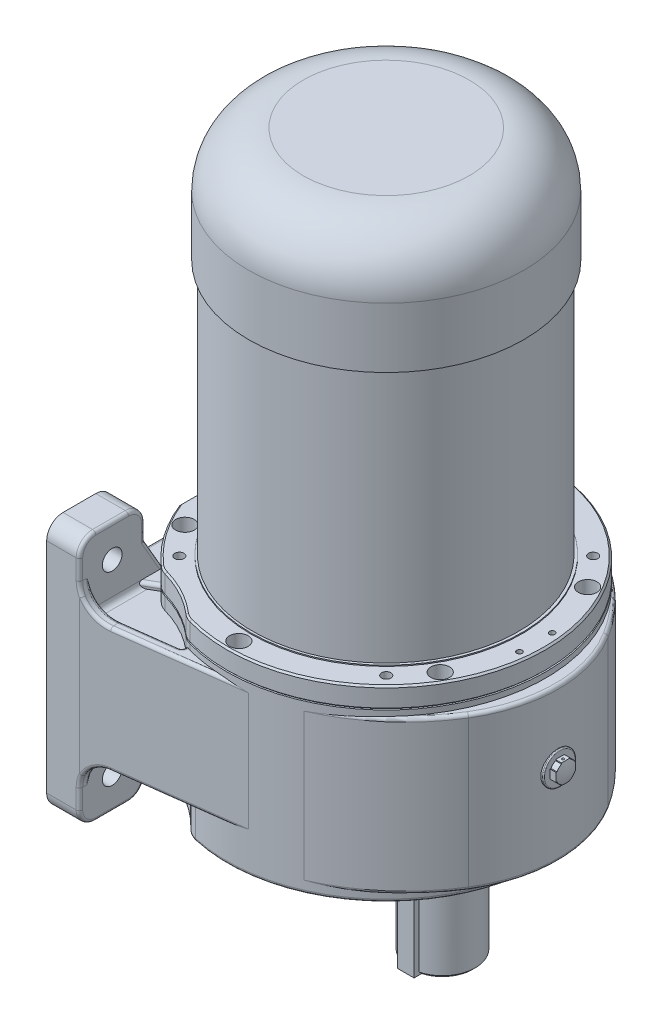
SolidWorks part; units mm, degrees
ref_plane "前视基准面" through (0, 0, 0) normal (0, 0, 1) x (1, 0, 0)
ref_plane "上视基准面" through (0, 0, 0) normal (0, 1, 0) x (1, 0, 0)
ref_plane "右视基准面" through (0, 0, 0) normal (1, 0, 0) x (0, 0, -1)
imported_body "50箱盖-1-surface1"
imported_body "卧式箱体-1-surface1"
imported_body "卧式箱体-1-surface2"
imported_body "复件 5034.2200.106-00-1-surface2"
imported_body "复件 5034.2200.106-00-1-surface3"
imported_body "复件 5034.2200.106-00-1-surface4"
imported_body "复件 5034.2200.106-00-1-surface5"
imported_body "复件 5034.2200.106-00-1-surface6"
imported_body "复件 5034.2200.106-00-1-surface7"
imported_body "复件 5034.2200.106-00-1-surface8"
imported_body "复件 5034.2200.106-00-1-surface9"
imported_body "复件 5034.2200.106-00-1-surface10"
imported_body "复件 5034.2200.106-00-1-surface11"
imported_body "复件 5034.2200.106-00-1-surface12"
imported_body "复件 5034.2200.106-00-1-surface13"
imported_body "复件 5034.2200.106-00-1-surface14"
imported_body "复件 5034.2200.106-00-1-surface15"
imported_body "复件 5034.2200.106-00-1-surface16"
imported_body "复件 5034.2200.106-00-1-surface17"
imported_body "复件 5034.2200.106-00-1-surface18"
imported_body "复件 5034.2200.106-00-1-surface19"
imported_body "复件 5034.2200.106-00-1-surface20"
imported_body "复件 5034.2200.106-00-1-surface21"
imported_body "复件 5034.2200.106-00-1-surface22"
imported_body "复件 5034.2200.106-00-1-surface23"
imported_body "复件 5034.2200.106-00-1-surface24"
imported_body "复件 5034.2200.106-00-1-surface25"
imported_body "复件 5034.2200.106-00-1-surface26"
imported_body "复件 5034.2200.106-00-1-surface27"
imported_body "复件 5034.2200.106-00-1-surface28"
imported_body "复件 5034.2200.106-00-1-surface29"
imported_body "复件 5034.2200.106-00-1-surface30"
imported_body "复件 5034.2200.106-00-1-surface31"
imported_body "复件 5034.2200.106-00-1-surface32"
imported_body "复件 5034.2200.106-00-1-surface33"
imported_body "复件 5034.2200.106-00-1-surface34"
imported_body "复件 5034.2200.106-00-1-surface35"
imported_body "复件 5034.2200.106-00-1-surface36"
imported_body "复件 5034.2200.106-00-1-surface37"
imported_body "复件 5034.2200.106-00-1-surface38"
imported_body "复件 5034.2200.106-00-1-surface39"
imported_body "复件 5034.2200.106-00-1-surface40"
imported_body "复件 5034.2200.106-00-1-surface41"
imported_body "复件 5034.2200.106-00-1-surface42"
imported_body "复件 5034.2200.106-00-1-surface43"
imported_body "复件 5034.2200.106-00-1-surface44"
imported_body "复件 5034.2200.106-00-1-surface45"
imported_body "复件 5034.2200.106-00-1-surface46"
imported_body "复件 5034.2200.106-00-1-surface47"
imported_body "复件 5034.2200.106-00-1-surface48"
imported_body "复件 5034.2200.106-00-1-surface49"
imported_body "复件 5034.2200.106-00-1-surface50"
imported_body "复件 5034.2200.106-00-1-surface51"
imported_body "复件 5034.2200.106-00-1-surface52"
imported_body "复件 5034.2200.106-00-1-surface53"
imported_body "复件 5034.2200.106-00-1-surface54"
imported_body "复件 5034.2200.106-00-1-surface55"
imported_body "复件 5034.2200.106-00-1-surface56"
imported_body "复件 5034.2200.106-00-1-surface57"
imported_body "复件 5034.2200.106-00-1-surface58"
imported_body "复件 5034.2200.106-00-1-surface59"
imported_body "复件 5034.2200.106-00-1-surface60"
imported_body "复件 5034.2200.106-00-1-surface61"
imported_body "透气塞-1-surface1"
sketch "草图1" plane through (0, -196.7551, 0) normal (0, 1, 0) x (1, 0, 0)
  circle A0 centre (15.5509, 127.454) radius 122
  circle A1 centre (67.5509, 127.454) radius 52 construction
extrude "凸台-拉伸1" add sketch "草图1" along normal blind 234.5
sketch "草图2" plane through (0, 37.7449, 0) normal (0, 1, 0) x (1, 0, 0)
  circle A0 centre (16.0509, 127.454) radius 126
extrude "凸台-拉伸2" add sketch "草图2" along normal blind 105 separate body
fillet "圆角1" radius 50 1 edges at (16.0509, 142.7449, -1.454)
sketch "草图8" plane through (0, -395.2551, 0) normal (0, -1, 0) x (1, 0, 0)
  circle A0 centre (67.5509, -127.454) radius 30
extrude "凸台-拉伸3" add sketch "草图8" along normal blind 90 separate body
ref_plane "基准面1" through (0, 0, -97.43) normal (0, 0, 1) x (1, 0, 0)
sketch "草图9" plane through (0, 0, -97.43) normal (0, 0, 1) x (1, 0, 0)
  line L1 (37.5509, -485.2551) -> (97.5509, -485.2551) construction
  line L2 (60.0509, -408.2551) -> (60.0509, -485.2551)
  line L3 (60.0509, -485.2551) -> (75.0509, -485.2551)
  line L4 (75.0509, -485.2551) -> (75.0509, -408.2551)
  arc A0 (75.0509, -408.2551) -> (60.0509, -408.2551) centre (67.5509, -408.2551) ccw
extrude "切除-拉伸5" cut sketch "草图9" against normal blind 6.5
sketch "草图10" plane through (0, 0, -103.93) normal (0, 0, 1) x (1, 0, 0)
  line L0 (60.0509, -408.2551) -> (60.0509, -485.2551)
  line L1 (60.0509, -485.2551) -> (75.0509, -485.2551)
  line L2 (75.0509, -485.2551) -> (75.0509, -408.2551)
  arc A0 (75.0509, -408.2551) -> (60.0509, -408.2551) centre (67.5509, -408.2551) ccw
extrude "凸台-拉伸4" add sketch "草图10" along normal blind 10 separate body
chamfer "倒角1" distance 2.5 angle 45 1 edges at (67.5509, -485.2551, -157.454)
